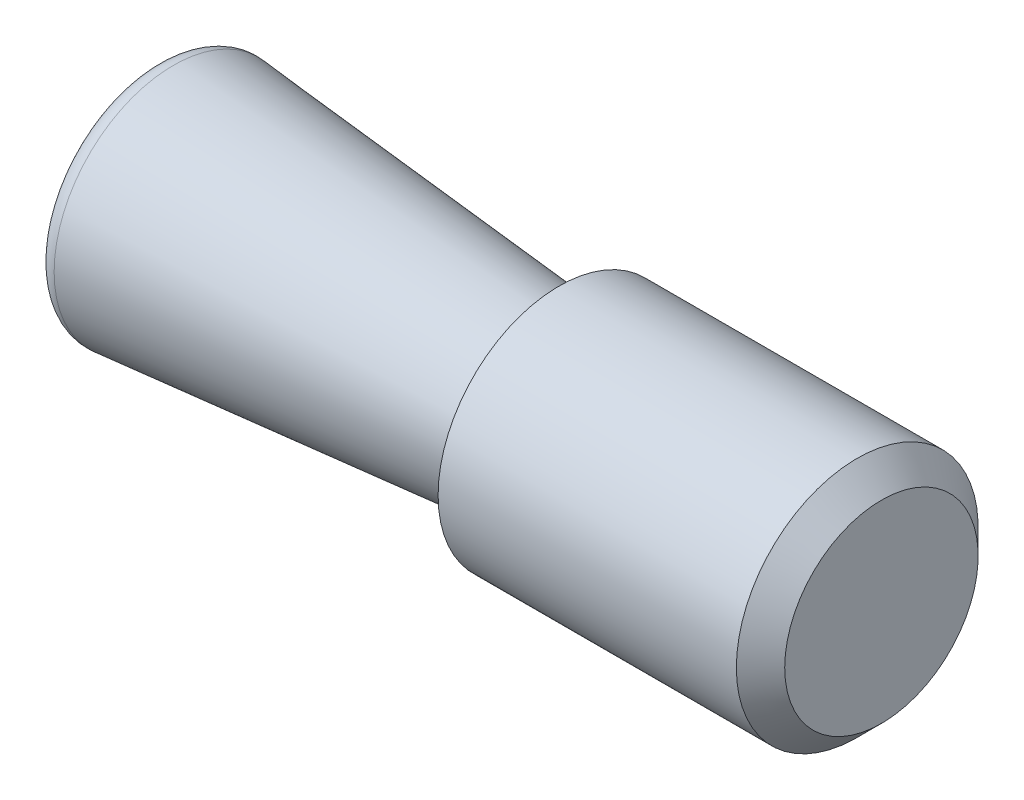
SolidWorks part; units mm, degrees
ref_plane "Front" through (0, 0, 0) normal (0, 0, 1) x (1, 0, 0)
ref_plane "Top" through (0, 0, 0) normal (0, 1, 0) x (1, 0, 0)
ref_plane "Right" through (0, 0, 0) normal (1, 0, 0) x (0, 0, -1)
sketch "Sketch1" plane through (0, 0, 0) normal (0, 0, 1) x (1, 0, 0)
  line L0 (0, 0) -> (9, 0)
  line L1 (9, 0) -> (9, 1.5)
  line L2 (9, 1.5) -> (5, 1.5)
  line L3 (5, 1.5) -> (5, 1.0626)
  line L4 (5, 1.0626) -> (0, 1.5)
  line L5 (0, 1.5) -> (0, 0)
  dimension "D1" = 1.5
  dimension "D2" = 1.5
  dimension "D3" = 4
  dimension "D4" = 9
  dimension "D5" = 4
revolve "Revolve1" add sketch "Sketch1" angle 360 about L0
fillet "Fillet1" radius 0.2 1 edges at (0, 0, 1.5)
chamfer "Chamfer1" distance 0.3 angle 45 1 edges at (9, 0, 1.5)
